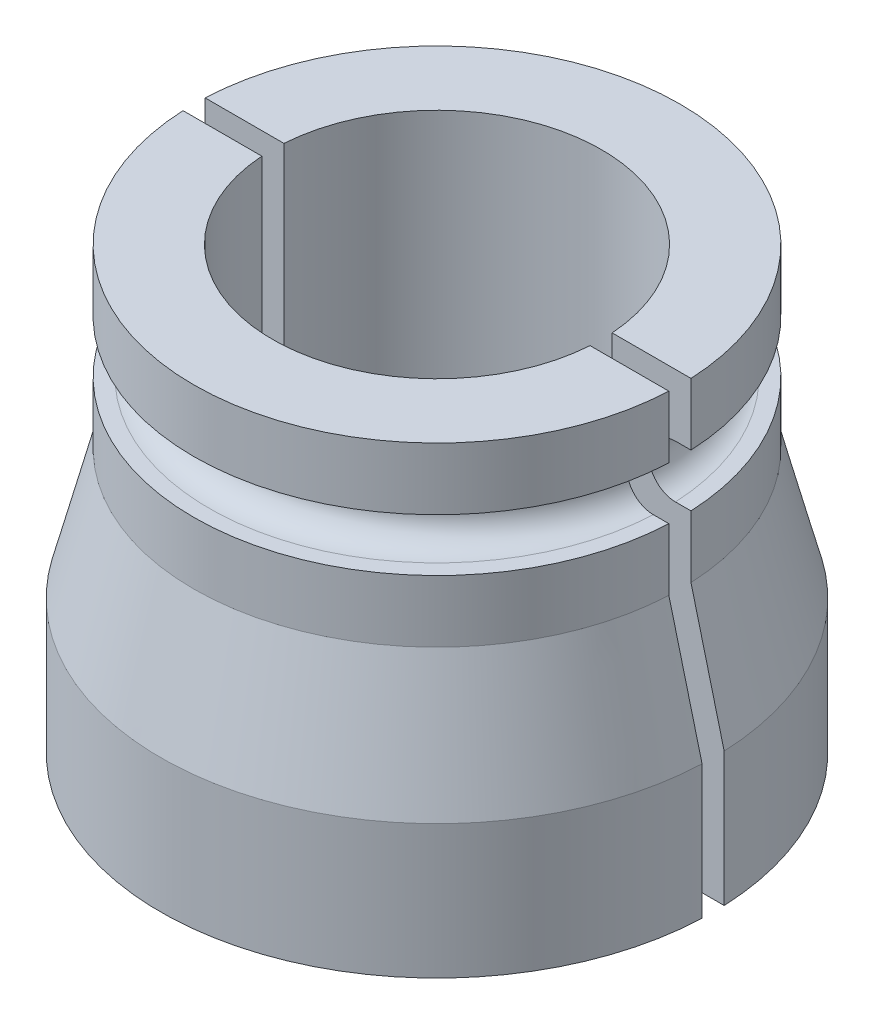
SolidWorks part; units mm, degrees
ref_plane "Front Plane" through (0, 0, 0) normal (0, 0, 1) x (1, 0, 0)
ref_plane "Top Plane" through (0, 0, 0) normal (0, 1, 0) x (1, 0, 0)
ref_plane "Right Plane" through (0, 0, 0) normal (1, 0, 0) x (0, 0, -1)
sketch "Sketch1" plane through (0, 0, 0) normal (0, 0, 1) x (1, 0, 0)
  line L0 (0, 0) -> (0, 32.5448) construction
  line L1 (7.44, 19.9) -> (11, 19.9)
  line L2 (11, 19.9) -> (11, 11.9)
  line L4 (15.5, 0.2) -> (15.5, -7.8) construction
  line L5 (14.85, -7.8) -> (11, -7.8)
  line L6 (11, -7.8) -> (11, 0)
  line L7 (11, 0) -> (7.44, 6.1661)
  line L8 (7.44, 6.1661) -> (7.44, 19.9)
  line L9 (11, 11.9) -> (14, 0.2)
  line L10 (14, 0.2) -> (14.85, 0.2)
  line L11 (14.85, 0.2) -> (14.85, -7.8)
  line L12 (11, 0) -> (12.5, 0)
  line L13 (12.5, 0) -> (12.5, 6.05)
  circle A0 centre (-41.8768, 11.9) radius 16.85
  circle A1 centre (-41.8768, 11.9) radius 14.85
  dimension "D9" = 33.7
  dimension "D10" = 2
  dimension "D11" = 29.7
  dimension "D1" = 11
  dimension "D2" = 30
  dimension "D3" = 7.44
  dimension "D4" = 8
  dimension "D5" = 11
  dimension "D6" = 15.5
  dimension "D7" = 19.9
  dimension "D8" = 19.7
  dimension "D12" = 8
  dimension "D13" = 1.5
  dimension "D14" = 14.85
  dimension "D15" = 0.85
  dimension "D16" = 1.5
revolve "Revolve1" add sketch "Sketch1" angle 360 about L0
sketch "Sketch2" plane through (0, 0, 0) normal (1, 0, 0) x (0, 0, -1)
  line L1 (-11, 15.9) -> (-11, 19.9) construction
  line L2 (-11, 15.9) -> (-11, 11.9) construction
  line L3 (-11, 15.9) -> (-10.3, 15.9) construction
  line L4 (-10.3, 17.0906) -> (-11, 17.0906)
  line L5 (-10.3, 14.7094) -> (-11, 14.7094)
  line L6 (-11, 14.7094) -> (-11, 14.9369)
  line L7 (-11, 17.0906) -> (-11, 16.8631)
  circle A3 centre (-10.3, 15.9) radius 1.1906
  point P11 (-11, 19.9)
  dimension "D1" = 2.3813
  dimension "D2" = 0.7
ref_axis "Axis1" through (0, 25.112, 0) along (0, -1, 0)
revolve "Cut-Revolve1" cut sketch "Sketch2" angle 360 about axis through (0, 25.112, 0) along (0, -1, 0)
sketch "Sketch3" plane through (0, 0, 0) normal (0, 0, 1) x (1, 0, 0)
  line L0 (11, 19.9) -> (-11, 19.9) construction
  line L1 (-12.5, 0) -> (12.5, 0)
  line L2 (-12.5, 0) -> (-12.5, 19.9)
  line L3 (-12.5, 19.9) -> (12.5, 19.9)
  line L4 (12.5, 0) -> (12.5, 19.9)
  point P7 (0, 0)
extrude "Cut-Extrude1" cut sketch "Sketch3" against normal mid plane 1
